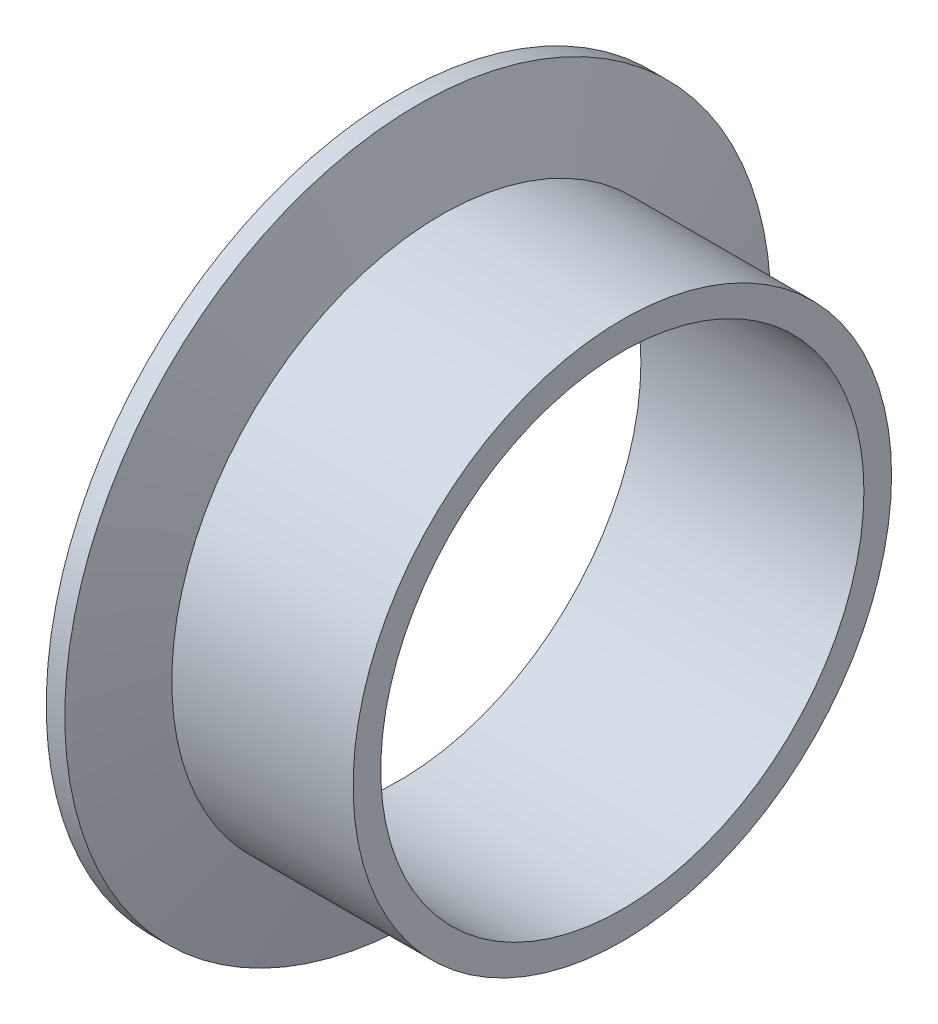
SolidWorks part; units mm, degrees
ref_plane "Front" through (0, 0, 0) normal (0, 0, 1) x (1, 0, 0)
ref_plane "Top" through (0, 0, 0) normal (0, 1, 0) x (1, 0, 0)
ref_plane "Right" through (0, 0, 0) normal (1, 0, 0) x (0, 0, -1)
sketch "Sketch1" plane through (0, 0, 0) normal (0, 0, 1) x (1, 0, 0)
  line L0 (112.8183, 22.9997) -> (97.332, 22.9997)
  line L1 (97.332, 22.9997) -> (95.3558, 30.1625)
  line L2 (95.3558, 30.1625) -> (93.7683, 30.1625)
  line L3 (93.7683, 30.1625) -> (93.7683, 20.6375)
  line L4 (93.7683, 20.6375) -> (112.8183, 20.6375)
  line L5 (112.8183, 20.6375) -> (112.8183, 22.9997)
  line L6 (125.7203, 0) -> (87.8235, 0) construction
  arc A0 (97.2958, 23.1521) -> (22.225, 97.5118) centre (0, 0) ccw construction
  dimension "D1" = 41.275
  dimension "D2" = 45.9994
  dimension "D3" = 19.05
  dimension "D4" = 60.325
  dimension "D5" = 1.5875
revolve "Revolve1" add sketch "Sketch1" angle 360 about L6
